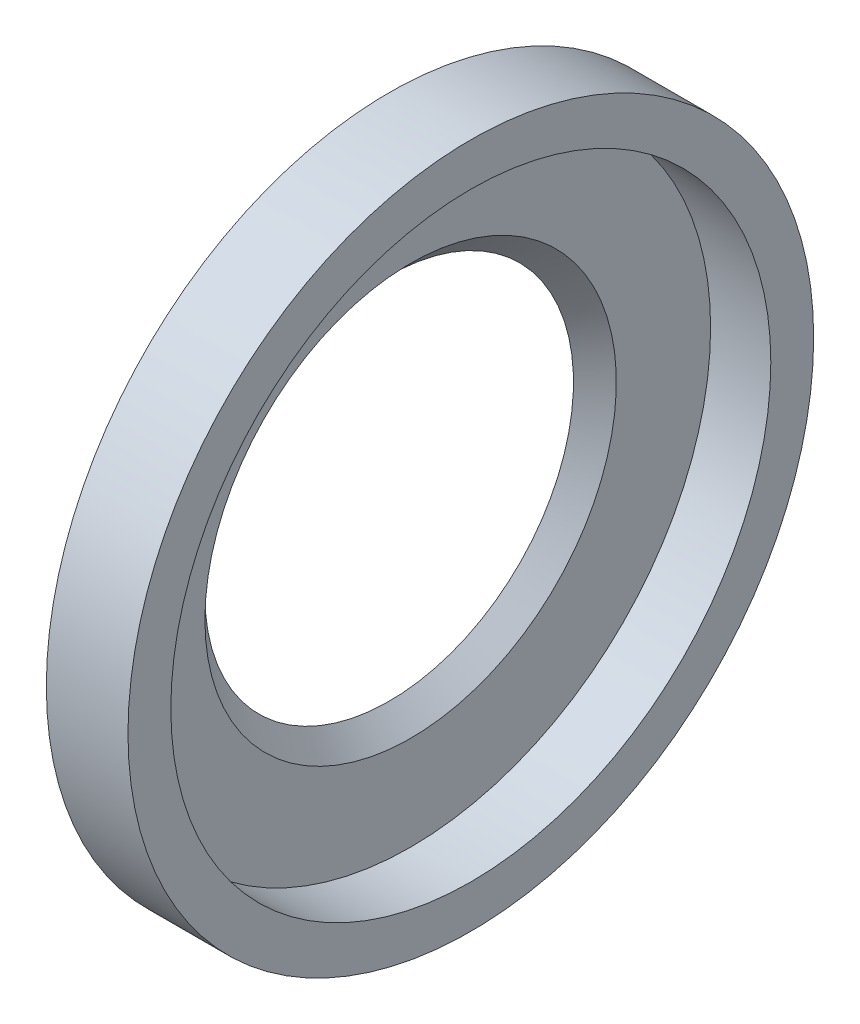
SolidWorks part; units mm, degrees
ref_plane "Front Plane" through (0, 0, 0) normal (0, 0, 1) x (1, 0, 0)
ref_plane "Top Plane" through (0, 0, 0) normal (0, 1, 0) x (1, 0, 0)
ref_plane "Right Plane" through (0, 0, 0) normal (1, 0, 0) x (0, 0, -1)
sketch "Sketch1" plane through (0, 0, 0) normal (0, 0, 1) x (1, 0, 0)
  line L0 (0, 0) -> (59.2185, 0) construction
  line L1 (0, 6.8267) -> (0, 12.7)
  line L2 (0, 12.7) -> (3.0239, 12.7)
  line L3 (3.0239, 12.7) -> (3.0239, 11.1125)
  line L4 (3.0239, 11.1125) -> (0.7938, 11.1125)
  line L5 (0.7938, 11.1125) -> (0.7938, 7.6205)
  line L6 (0.7938, 7.6205) -> (0, 6.8267)
  dimension "D1" = 6.8267
  dimension "D2" = 0.7937
  dimension "D3" = 1.5875
  dimension "D4" = 11.1125
  dimension "D5" = 45
  dimension "D6" = 3.0239
revolve "Revolve1" add sketch "Sketch1" angle 360 about L0
